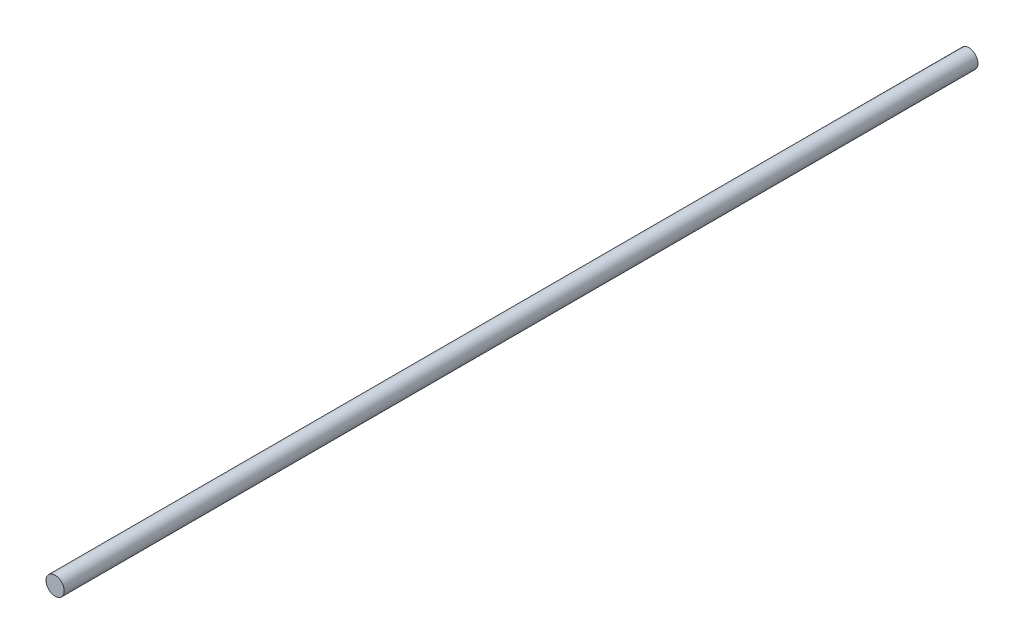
SolidWorks part; units mm, degrees
ref_plane "Front Plane" through (0, 0, 0) normal (0, 0, 1) x (1, 0, 0)
ref_plane "Top Plane" through (0, 0, 0) normal (0, 1, 0) x (1, 0, 0)
ref_plane "Right Plane" through (0, 0, 0) normal (1, 0, 0) x (0, 0, -1)
sketch "Sketch1" plane through (0, 0, 0) normal (0, 0, 1) x (1, 0, 0)
  circle A0 centre (0, 0) radius 10
  dimension "D1" = 20
extrude "Boss-Extrude1" add sketch "Sketch1" along normal blind 1000
